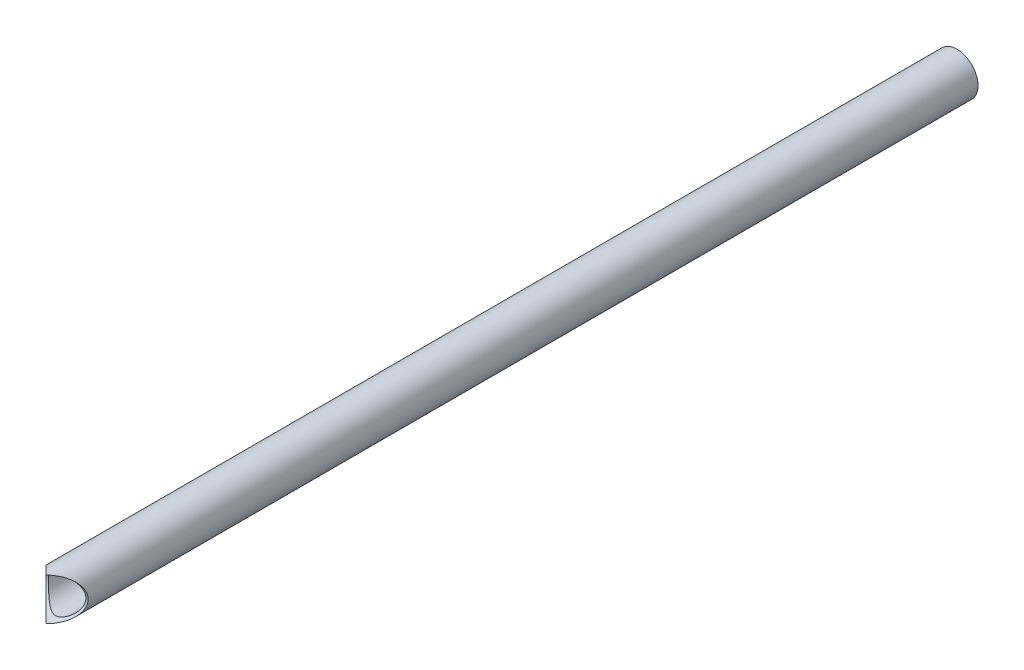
SolidWorks part; units mm, degrees
ref_plane "Plan1" through (0, 0, 0) normal (0, 0, 1) x (1, 0, 0)
ref_plane "Plan2" through (0, 0, 0) normal (0, 1, 0) x (1, 0, 0)
ref_plane "Plan3" through (0, 0, 0) normal (1, 0, 0) x (0, 0, -1)
sketch "Esquisse2" plane through (0, 0, -1101) normal (0, 0, -1) x (-1, 0, 0)
  circle A0 centre (193, 0) radius 14
  arc A1 (204, 8.6603) -> (182, 8.6603) centre (193, 0) ccw construction
  circle A2 centre (193, 0) radius 12.5
  dimension "D1" = 1.5
extrude "Base-Extrusion" add sketch "Esquisse2" against normal up to surface (541 mm away)
sketch "Esquisse3" plane through (0, 0, -1101) normal (0, 0, -1) x (-1, 0, 0)
  circle A0 centre (193, 0) radius 12.5 construction
  circle A1 centre (193, 0) radius 14
  circle A2 centre (193, 0) radius 14
  circle A3 centre (193, 0) radius 12.5
  dimension "D1" = 0
extrude "Boss.-Extru.1" add sketch "Esquisse3" along normal blind 50
